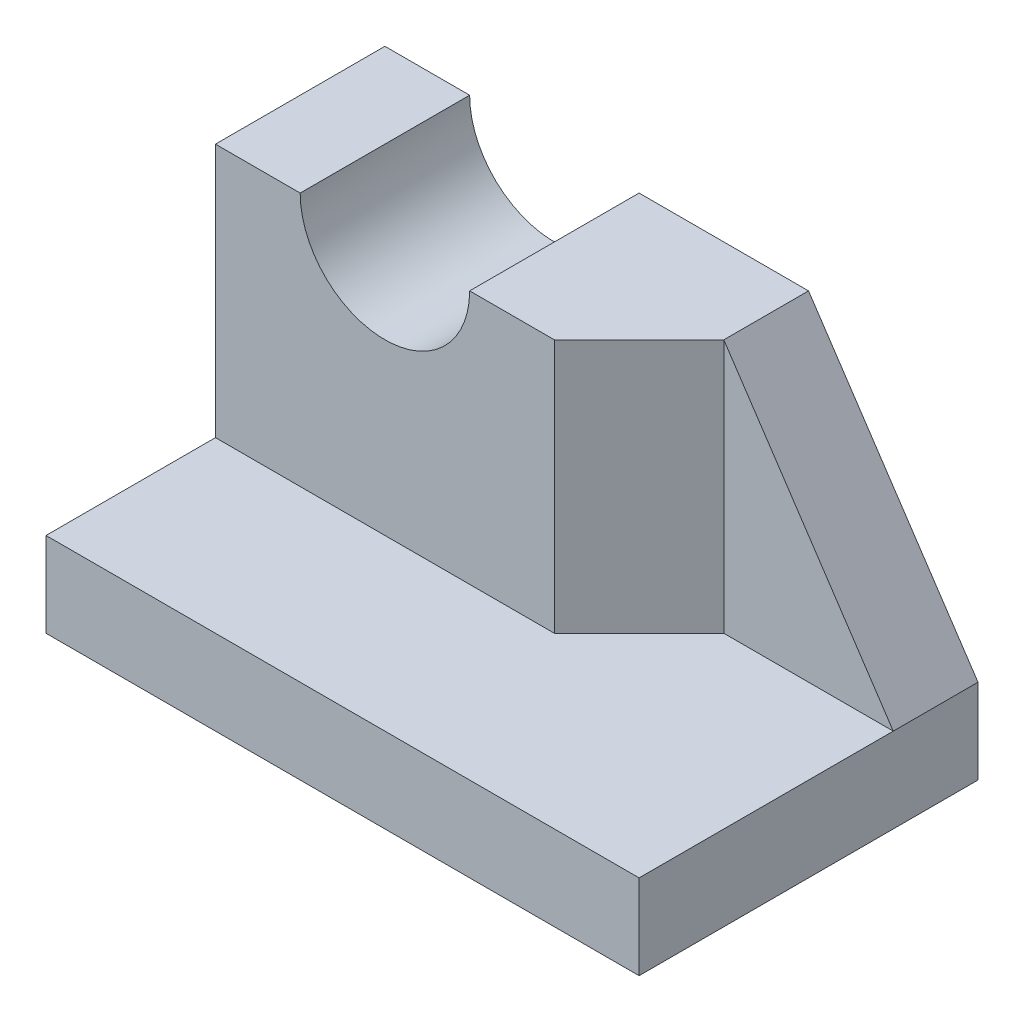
SolidWorks part; units mm, degrees
ref_plane "Front Plane" through (0, 0, 0) normal (0, 0, 1) x (1, 0, 0)
ref_plane "Top Plane" through (0, 0, 0) normal (0, 1, 0) x (1, 0, 0)
ref_plane "Right Plane" through (0, 0, 0) normal (1, 0, 0) x (0, 0, -1)
sketch "Sketch2" plane through (0, 0, 0) normal (0, 1, 0) x (1, 0, 0)
  line L0 (-35, -20) -> (35, 20) construction
  line L1 (-35, -20) -> (35, -20)
  line L2 (-35, -20) -> (-35, 20)
  line L3 (-35, 20) -> (35, 20)
  line L4 (35, -20) -> (35, 20)
  dimension "D1" = 70
  dimension "D2" = 40
extrude "Extrude1" add sketch "Sketch2" along normal blind 10
sketch "Sketch3" plane through (0, 10, 0) normal (0, 1, 0) x (1, 0, 0)
  line L0 (-35, 0) -> (5, 0)
  line L1 (-35, 20) -> (-35, -20) construction
  line L2 (5, 0) -> (15, 10)
  line L3 (15, 10) -> (15, 20)
  line L6 (35, -20) -> (35, 20) construction
  line L7 (15, 20) -> (-35, 20)
  line L8 (-35, 20) -> (-35, 0)
  dimension "D1" = 45
  dimension "D2" = 20
  dimension "D3" = 40
  dimension "D4" = 10
extrude "Extrude2" add sketch "Sketch3" along normal blind 30
sketch "Sketch4" plane through (0, 0, 0) normal (0, 0, 1) x (1, 0, 0)
  line L0 (-35, 40) -> (5, 40) construction
  circle A0 centre (-15, 40) radius 10
  dimension "D1" = 10
extrude "Extrude3" cut sketch "Sketch4" against normal blind 30
sketch "Sketch5" plane through (0, 0, -20) normal (0, 0, -1) x (-1, 0, 0)
  line L0 (-15, 40) -> (-35, 10)
rib "Rib1" sketch "Sketch5" sketch "Sketch5" thickness 10 extrusion direction parallel to sketch draft on no parameters "D1"=10
